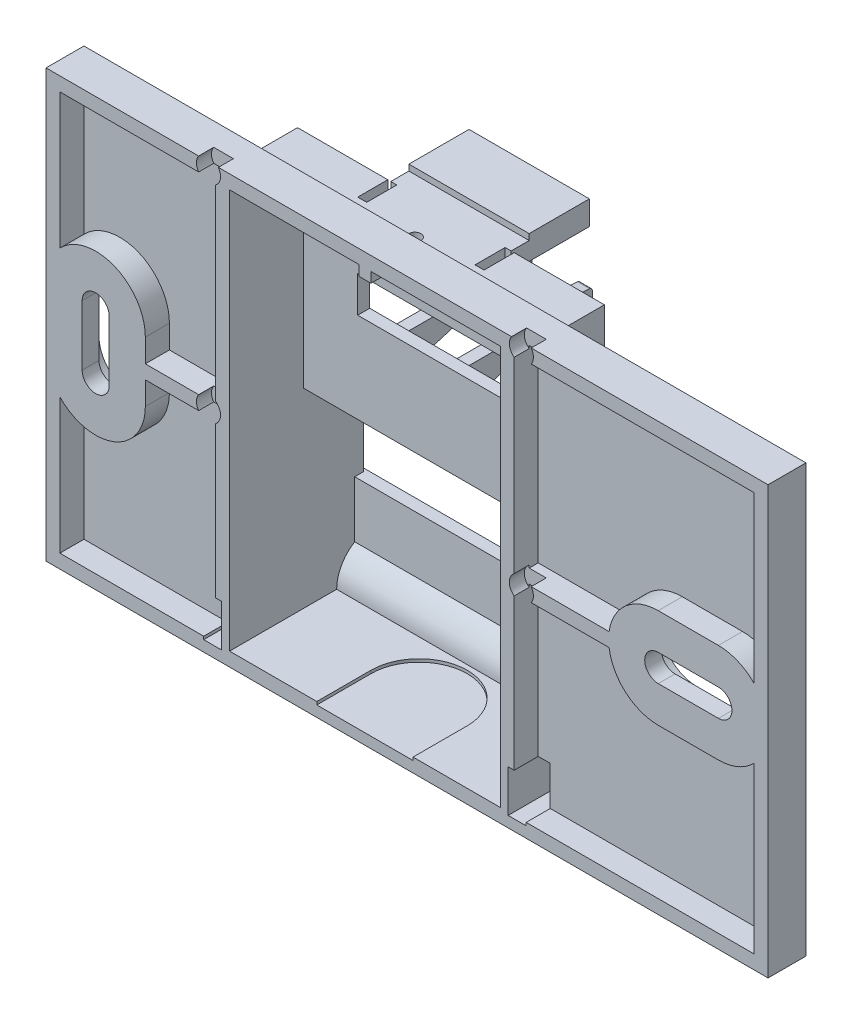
SolidWorks part; units mm, degrees
ref_plane "Plan1" through (0, 0, 0) normal (0, 0, 1) x (1, 0, 0)
ref_plane "Plan2" through (0, 0, 0) normal (0, 1, 0) x (1, 0, 0)
ref_plane "Plan3" through (0, 0, 0) normal (1, 0, 0) x (0, 0, -1)
sketch "Esquisse1" plane through (0, 0, 0) normal (0, 0, 1) x (1, 0, 0)
  line L1 (-53, 0) -> (67, 0)
  line L2 (-53, 0) -> (-53, -71)
  line L3 (-53, -71) -> (67, -71)
  line L4 (67, 0) -> (67, -71)
  dimension "D1" = 120
  dimension "D2" = 53
  dimension "D3" = 71
extrude "Extrusion1" add sketch "Esquisse1" along normal blind 2.3
sketch "Esquisse2" plane through (0, 0, 2.3) normal (0, 0, 1) x (1, 0, 0)
  line L0 (-50.7, -2.3) -> (-50.7, -24.7851)
  line L1 (-53, 0) -> (67, 0)
  line L2 (-53, 0) -> (-53, -30.5)
  line L3 (-53, -71) -> (67, -71)
  line L4 (67, 0) -> (67, -71)
  line L5 (-50.7, -68.7) -> (-24.8, -68.7)
  line L6 (64.7, -2.3) -> (64.7, -29.7851)
  line L7 (-50.7, -2.3) -> (-24.8, -2.3)
  line L8 (-22.5, -2.3) -> (-22.5, -68.7)
  line L9 (22.5, -2.3) -> (22.5, -68.7)
  line L10 (-24.8, -2.3) -> (-24.8, -34.35)
  line L11 (24.8, -2.3) -> (24.8, -34.35)
  line L12 (24.8, -2.3) -> (64.7, -2.3)
  line L13 (-50.7, -2.3) -> (64.7, -2.3) construction
  line L14 (24.8, -68.7) -> (64.7, -68.7)
  line L15 (-22.5, -2.3) -> (22.5, -2.3)
  line L16 (-50.7, -68.7) -> (64.7, -68.7) construction
  line L17 (-53, -35.5) -> (67, -35.5) construction
  line L18 (-22.5, -68.7) -> (22.5, -68.7)
  line L19 (-47, -40.5) -> (-47, -30.5)
  line L20 (-42.5, -40.5) -> (-42.5, -30.5)
  line L21 (48.75, -33.25) -> (58.75, -33.25)
  line L22 (-36.5, -40.5) -> (-36.5, -36.65)
  line L23 (-53, -30.5) -> (-53, -71)
  line L24 (-53, 0) -> (-53, -71) construction
  line L25 (-50.7, -46.2149) -> (-50.7, -68.7)
  line L26 (-50.7, -2.3) -> (-50.7, -68.7) construction
  line L27 (-53, -40.5) -> (-53, -30.5) construction
  line L28 (48.75, -37.75) -> (58.75, -37.75)
  line L29 (48.75, -27.25) -> (58.75, -27.25)
  line L30 (48.75, -43.75) -> (58.75, -43.75)
  line L31 (-36.5, -34.35) -> (-24.8, -34.35)
  line L32 (64.7, -2.3) -> (64.7, -68.7) construction
  line L33 (64.7, -41.2149) -> (64.7, -68.7)
  line L34 (-36.5, -36.65) -> (-24.8, -36.65)
  line L35 (-36.5, -34.35) -> (-36.5, -30.5)
  line L36 (-36.5, -40.5) -> (-36.5, -30.5) construction
  line L37 (40.5805, -34.35) -> (24.8, -34.35)
  line L38 (40.5805, -36.65) -> (24.8, -36.65)
  line L39 (-24.8, -2.3) -> (-24.8, -68.7) construction
  line L40 (-24.8, -36.65) -> (-24.8, -68.7)
  line L42 (24.8, -2.3) -> (24.8, -68.7) construction
  line L43 (24.8, -36.65) -> (24.8, -68.7)
  arc A0 (-47, -30.5) -> (-42.5, -30.5) centre (-44.75, -30.5) cw
  arc A1 (-47, -40.5) -> (-42.5, -40.5) centre (-44.75, -40.5) ccw
  arc A2 (-50.7, -46.2149) -> (-36.5, -40.5) centre (-44.75, -40.5) ccw
  arc A3 (48.75, -33.25) -> (48.75, -37.75) centre (48.75, -35.5) ccw
  arc A4 (-50.7, -24.7851) -> (-36.5, -30.5) centre (-44.75, -30.5) cw
  arc A5 (-53, -30.5) -> (-36.5, -30.5) centre (-44.75, -30.5) cw construction
  arc A6 (-53, -40.5) -> (-36.5, -40.5) centre (-44.75, -40.5) ccw construction
  arc A7 (58.75, -37.75) -> (58.75, -33.25) centre (58.75, -35.5) ccw
  arc A8 (58.75, -43.75) -> (64.7, -41.2149) centre (58.75, -35.5) ccw
  arc A9 (48.75, -27.25) -> (40.5805, -34.35) centre (48.75, -35.5) ccw
  arc A10 (64.7, -29.7851) -> (58.75, -27.25) centre (58.75, -35.5) ccw
  arc A11 (58.75, -43.75) -> (58.75, -27.25) centre (58.75, -35.5) ccw construction
  arc A13 (48.75, -27.25) -> (48.75, -43.75) centre (48.75, -35.5) ccw construction
  arc A14 (40.5805, -36.65) -> (48.75, -43.75) centre (48.75, -35.5) ccw
  point P21 (-47, -35.5)
  point P29 (-42.5, -35.5)
  point P60 (0, 0)
  dimension "D12" = 2.25
  dimension "D2" = 45
  dimension "D3" = 30.5
  dimension "D6" = 68.7
  dimension "D7" = 4.5
  dimension "D8" = 6
  dimension "D9" = 10
  dimension "D11" = 22.4851
  dimension "D13" = 8.25
  dimension "D14" = 10
  dimension "D16" = 27.4851
  dimension "D17" = 2.3
  dimension "D18" = 2.3
  dimension "D1" = 2.3
  dimension "D4" = 2.3
  dimension "D5" = 2.3
  dimension "D10" = 6
  dimension "D15" = 6
extrude "Extrusion2" add sketch "Esquisse2" along normal blind 4
sketch "Esquisse3" plane through (0, 0, 2.3) normal (0, 0, 1) x (1, 0, 0)
  line L0 (-22.5, -68.7) -> (22.5, -68.7) construction
  line L1 (-22.5, -2.3) -> (22.5, -2.3)
  line L2 (-22.5, -2.3) -> (-22.5, -68.7)
  line L3 (-22.5, -68.7) -> (22.5, -68.7)
  line L4 (22.5, -2.3) -> (22.5, -68.7)
  line L5 (22.5, -68.7) -> (22.5, -2.3) construction
extrude "Enlèv. mat.-Extru.1" cut sketch "Esquisse3" against normal through all
sketch "Esquisse4" plane through (0, 0, 0) normal (0, 0, -1) x (-1, 0, 0)
  line L4 (39, -30.5) -> (39, -40.5)
  line L5 (50.5, -40.5) -> (50.5, -30.5)
  line L6 (39, -30.5) -> (39, -40.5)
  line L7 (50.5, -40.5) -> (50.5, -30.5)
  line L10 (-48.75, -29.75) -> (-58.75, -29.75)
  line L11 (-58.75, -41.25) -> (-48.75, -41.25)
  line L12 (-48.75, -29.75) -> (-58.75, -29.75)
  line L13 (-58.75, -41.25) -> (-48.75, -41.25)
  arc A4 (50.5, -30.5) -> (39, -30.5) centre (44.75, -30.5) ccw
  arc A5 (39, -40.5) -> (50.5, -40.5) centre (44.75, -40.5) ccw
  arc A6 (50.5, -30.5) -> (39, -30.5) centre (44.75, -30.5) ccw
  arc A7 (39, -40.5) -> (50.5, -40.5) centre (44.75, -40.5) ccw
  arc A10 (-48.75, -41.25) -> (-48.75, -29.75) centre (-48.75, -35.5) ccw
  arc A11 (-58.75, -29.75) -> (-58.75, -41.25) centre (-58.75, -35.5) ccw
  arc A12 (-48.75, -41.25) -> (-48.75, -29.75) centre (-48.75, -35.5) ccw
  arc A13 (-58.75, -29.75) -> (-58.75, -41.25) centre (-58.75, -35.5) ccw
  dimension "D1" = 3.5
  dimension "D2" = 3.5
extrude "Enlèv. mat.-Extru.2" cut sketch "Esquisse4" against normal blind 3.5
sketch "Esquisse5" plane through (0, 0, 6.3) normal (0, 0, 1) x (1, 0, 0)
  line L0 (0, 0) -> (0, -48.8173) construction
  line L1 (-22.5, -2.3) -> (-22.5, -68.7) construction
  line L2 (-36.5, -34.35) -> (-24.8, -34.35) construction
  circle A0 centre (-26, -1.15) radius 2
  circle A1 centre (-26, -35.5009) radius 2
  circle A2 centre (26, -35.5009) radius 2
  circle A3 centre (26, -1.15) radius 2
  dimension "D1" = 4
  dimension "D2" = 4
  dimension "D3" = 3.5
  dimension "D4" = 1.15
  dimension "D5" = 1.1509
extrude "Enlèv. mat.-Extru.3" cut sketch "Esquisse5" against normal blind 2.5
sketch "Esquisse6" plane through (0, 0, 0) normal (0, 0, -1) x (-1, 0, 0)
  line L0 (22.5, -2.3) -> (22.5, -68.7) construction
  line L1 (-22.5, -68.7) -> (22.5, -68.7)
  line L2 (-22.5, -68.7) -> (-22.5, -4)
  line L3 (-22.5, -4) -> (22.5, -4)
  line L4 (22.5, -68.7) -> (22.5, -4)
  line L5 (53, -71) -> (-67, -71) construction
  line L6 (-25.5, -71) -> (25.5, -71)
  line L7 (-25.5, -71) -> (-25.5, -2)
  line L8 (-25.5, -2) -> (25.5, -2)
  line L9 (25.5, -71) -> (25.5, -2)
  dimension "D1" = 64.7
  dimension "D2" = 3
  dimension "D3" = 3
  dimension "D4" = 2
extrude "Extrusion3" add sketch "Esquisse6" along normal blind 16
sketch "Esquisse7" plane through (25.5, 0, 0) normal (1, 0, 0) x (0, 0, -1)
  line L0 (16, -71) -> (0, -71) construction
  line L1 (14.5, -71) -> (16, -71)
  line L2 (14.5, -71) -> (14.5, -54)
  line L3 (14.5, -54) -> (16, -54)
  line L4 (16, -71) -> (16, -54)
  line L5 (16, -2) -> (16, -71) construction
  dimension "D1" = 17
  dimension "D2" = 1.5
extrude "Enlèv. mat.-Extru.4" cut sketch "Esquisse7" against normal through all
sketch "Esquisse8" plane through (22.5, 0, 0) normal (-1, 0, 0) x (0, 0, 1)
  line L0 (-23.1986, -68.7) -> (-21.6791, -68.7)
  line L1 (-14.5, -68.7) -> (-14.5, -71)
  line L2 (-11.5, -68.7) -> (-11.5, -71)
  line L3 (-14.5, -71) -> (0, -71) construction
  line L4 (-11.5, -71) -> (-14.5, -71)
  arc A0 (-14.5, -68.7) -> (-20.9424, -68.0906) centre (-17.75, -68.7) ccw
  arc A1 (-11.5, -68.7) -> (-23.9416, -67.8477) centre (-17.75, -68.7) ccw
  arc A2 (-11.5, -68.7) -> (-24, -68.7) centre (-17.75, -68.7) ccw construction
  arc A3 (-23.1986, -68.7) -> (-23.9416, -67.8477) centre (-23.1986, -67.95) cw
  arc A4 (-14.5, -68.7) -> (-21, -68.7) centre (-17.75, -68.7) ccw construction
  arc A5 (-20.9424, -68.0906) -> (-21.6791, -68.7) centre (-21.6791, -67.95) cw
  dimension "D1" = 3.25
  dimension "D2" = 3
  dimension "D3" = 0.75
extrude "Extrusion4" add sketch "Esquisse8" along normal up to surface (51 mm away) from offset 3
sketch "Esquisse9" plane through (0, -54, 0) normal (0, -1, 0) x (1, 0, 0)
  line L0 (-25.5, -14.5) -> (-25.5, -20.9424) construction
  line L1 (25.5, -14.5) -> (-25.5, -14.5)
  line L2 (25.5, -14.5) -> (25.5, -16.5)
  line L3 (25.5, -16.5) -> (-25.5, -16.5)
  line L4 (-25.5, -14.5) -> (-25.5, -16.5)
  dimension "D1" = 2
extrude "Extrusion5" add sketch "Esquisse9" along normal up to next
sketch "Esquisse10" plane through (-25.5, 0, 0) normal (-1, 0, 0) x (0, 0, 1)
  line L1 (-16, -2) -> (-8, -2)
  line L2 (-16, -2) -> (-16, -28.5)
  line L3 (-16, -28.5) -> (-8, -28.5)
  line L4 (-8, -2) -> (-8, -28.5)
  dimension "D1" = 26.5
  dimension "D2" = 8
extrude "Enlèv. mat.-Extru.5" cut sketch "Esquisse10" against normal through all
sketch "Esquisse11" plane through (0, -4, 0) normal (0, -1, 0) x (1, 0, 0)
  line L0 (-25.5, -8) -> (-25.5, 0) construction
  line L1 (25.5, -8) -> (-25.5, -8)
  line L2 (25.5, -8) -> (25.5, -6)
  line L3 (25.5, -6) -> (-25.5, -6)
  line L4 (-25.5, -8) -> (-25.5, -6)
  dimension "D1" = 2
extrude "Extrusion6" add sketch "Esquisse11" along normal blind 33
sketch "Esquisse12" plane through (0, 0, -6) normal (0, 0, 1) x (1, 0, 0)
  line L0 (22.5, -37) -> (-22.5, -37) construction
  line L1 (-13.5, -16) -> (13.5, -16)
  line L2 (-13.5, -16) -> (-13.5, -22)
  line L3 (-13.5, -22) -> (13.5, -22)
  line L4 (13.5, -16) -> (13.5, -22)
  line L5 (-22.5, -2.3) -> (-22.5, -68.7) construction
  line L6 (-22.5, -4) -> (22.5, -4) construction
  line L7 (-11.25, -4) -> (11.25, -4)
  line L8 (-11.25, -4) -> (-11.25, -8)
  line L9 (-11.25, -8) -> (11.25, -8)
  line L10 (11.25, -4) -> (11.25, -8)
  dimension "D1" = 15
  dimension "D2" = 27
  dimension "D3" = 9
  dimension "D4" = 6
  dimension "D5" = 22.5
  dimension "D6" = 11.25
  dimension "D7" = 4
extrude "Enlèv. mat.-Extru.6" cut sketch "Esquisse12" against normal through all
sketch "Esquisse13" plane through (0, -2, 0) normal (0, 1, 0) x (-1, 0, 0)
  line L0 (-25.5, -8) -> (25.5, -8) construction
  line L1 (9, -8) -> (10.5, -8)
  line L2 (9, -8) -> (9, -3)
  line L3 (9, -3) -> (10.5, -3)
  line L4 (10.5, -8) -> (10.5, -3)
  line L5 (0, 0) -> (0, -8.4558) construction
  line L6 (-10.5, -8) -> (-10.5, -3)
  line L7 (-9, -3) -> (-10.5, -3)
  line L8 (-9, -8) -> (-9, -3)
  line L9 (-9, -8) -> (-10.5, -8)
  circle A0 centre (0, -2) radius 1
  dimension "D4" = 2
  dimension "D1" = 5
  dimension "D2" = 1.5
  dimension "D3" = 9
  dimension "D5" = 2
extrude "Enlèv. mat.-Extru.7" cut sketch "Esquisse13" against normal blind 3
sketch "Esquisse14" plane through (0, 0, 0) normal (1, 0, 0) x (0, 0, -1)
  line L0 (8, -2) -> (11, -2)
  line L2 (8, -2) -> (8, -5)
  line L3 (8, -5) -> (21, -5)
  line L6 (21, -5) -> (21, -1)
  line L7 (21, -1) -> (11, -1)
  line L8 (11, -2) -> (11, -1)
  dimension "D1" = 4
  dimension "D2" = 13
  dimension "D3" = 10
  dimension "D4" = 3
extrude "Extrusion8" add sketch "Esquisse14" along normal mid plane 20
sketch "Esquisse15" plane through (0, 0, 6.3) normal (0, 0, 1) x (1, 0, 0)
  line L0 (-24.8, -68.7) -> (-24.8, -37.1009) construction
  line L1 (-26.8, -62.2) -> (-23.8, -62.2)
  line L2 (-26.8, -62.2) -> (-26.8, -69.2)
  line L3 (-26.8, -69.2) -> (-23.8, -69.2)
  line L4 (-23.8, -62.2) -> (-23.8, -69.2)
  line L5 (-22.5, -68.7) -> (22.5, -68.7) construction
  line L6 (0, 0) -> (0, -97.1933) construction
  line L7 (24.8, -37.1009) -> (24.8, -68.7) construction
  line L8 (23.8, -62.2) -> (26.8, -62.2)
  line L9 (23.8, -62.2) -> (23.8, -69.2)
  line L10 (23.8, -69.2) -> (26.8, -69.2)
  line L11 (26.8, -62.2) -> (26.8, -69.2)
  line L12 (24.8, -68.7) -> (64.7, -68.7) construction
  dimension "D1" = 1
  dimension "D2" = 3
  dimension "D3" = 0.5
  dimension "D4" = 7
  dimension "D5" = 7
  dimension "D6" = 3
  dimension "D7" = 1
  dimension "D8" = 0.5
extrude "Enlèv. mat.-Extru.8" cut sketch "Esquisse15" against normal blind 7
sketch "Esquisse16" plane through (0, -68.7, 0) normal (0, 1, 0) x (-1, 0, 0)
  line L0 (-8, 6.3) -> (-8, -2.7)
  line L1 (-24.3637, 6.3) -> (24.3637, 6.3) construction
  line L2 (0, 6.86) -> (0, -12.5957) construction
  line L3 (8, 6.3) -> (8, -2.7)
  line L4 (8, 6.3) -> (-8, 6.3)
  arc A0 (-8, -2.7) -> (8, -2.7) centre (0, -2.7) ccw
  dimension "D2" = 8
  dimension "D1" = 9
extrude "Enlèv. mat.-Extru.9" cut sketch "Esquisse16" against normal blind 0.5
sketch "Esquisse17" plane through (0, -2.3, 0) normal (0, -1, 0) x (1, 0, 0)
  line L0 (-53, 6.3) -> (67, 6.3) construction
  line L1 (1, 0) -> (-1, 0)
  line L2 (1, 0) -> (1, 6.3)
  line L3 (1, 6.3) -> (-1, 6.3)
  line L4 (-1, 0) -> (-1, 6.3)
  dimension "D1" = 2
  dimension "D2" = 1
extrude "Extrusion9" add sketch "Esquisse17" along normal up to surface (1.7 mm away)
sketch "Esquisse18" plane through (0, 0, 0) normal (1, 0, 0) x (0, 0, -1)
  line L0 (8, -16) -> (18, -16)
  line L1 (18, -16) -> (18, -16.2929)
  line L2 (18.8536, -16.6464) -> (20.3536, -15.1464)
  line L3 (20.5, -14.7929) -> (20.5, -13.4616)
  line L4 (20.0399, -12.9632) -> (8, -12)
  line L5 (8, -28.5) -> (8, -2) construction
  line L6 (8, -12) -> (8, -16)
  line L7 (8, -24) -> (17.5, -24)
  line L8 (18, -24.5) -> (18, -26.628)
  line L9 (17.6437, -27.1069) -> (8, -30)
  line L10 (8, -30) -> (8, -24)
  arc A0 (18.8536, -16.6464) -> (18, -16.2929) centre (18.5, -16.2929) cw
  arc A1 (20.5, -14.7929) -> (20.3536, -15.1464) centre (20, -14.7929) cw
  arc A2 (20.0399, -12.9632) -> (20.5, -13.4616) centre (20, -13.4616) cw
  arc A3 (18, -24.5) -> (17.5, -24) centre (17.5, -24.5) ccw
  arc A4 (17.6437, -27.1069) -> (18, -26.628) centre (17.5, -26.628) ccw
  point P16 (18, -17.5)
  point P19 (20.5, -15)
  point P22 (20.5, -13)
  point P25 (18, -24)
  point P28 (18, -27)
  dimension "D11" = 0.5
  dimension "D1" = 4
  dimension "D2" = 6
  dimension "D3" = 8
  dimension "D4" = 3
  dimension "D5" = 10
  dimension "D6" = 12.5
  dimension "D7" = 10
  dimension "D8" = 2
  dimension "D9" = 1.5
  dimension "D10" = 1
extrude "Extrusion10" add sketch "Esquisse18" along normal mid plane 2
fillet "Congé1" radius 0.5 7 edges at (0, -12, -8) (1, -14, -8) (0, -24, -8) (1, -27, -8) (-1, -14, -8) (0, -30, -8) (-1, -27, -8)
pattern_linear "Répétition linéaire1" count 2 spacing 10 along (-1, 0, 0) count 2 spacing 10 along (1, 0, 0) of "Extrusion10"
fillet "Congé2" radius 0.5 14 edges at (10, -12, -8) (11, -14, -8) (11, -27, -8) (10, -24, -8) (9, -14, -8) (9, -27, -8) (10, -30, -8) (-10, -30, -8) (-11, -27, -8) (-11, -14, -8) (-10, -24, -8) (-9, -27, -8) (-9, -14, -8) (-10, -12, -8)
